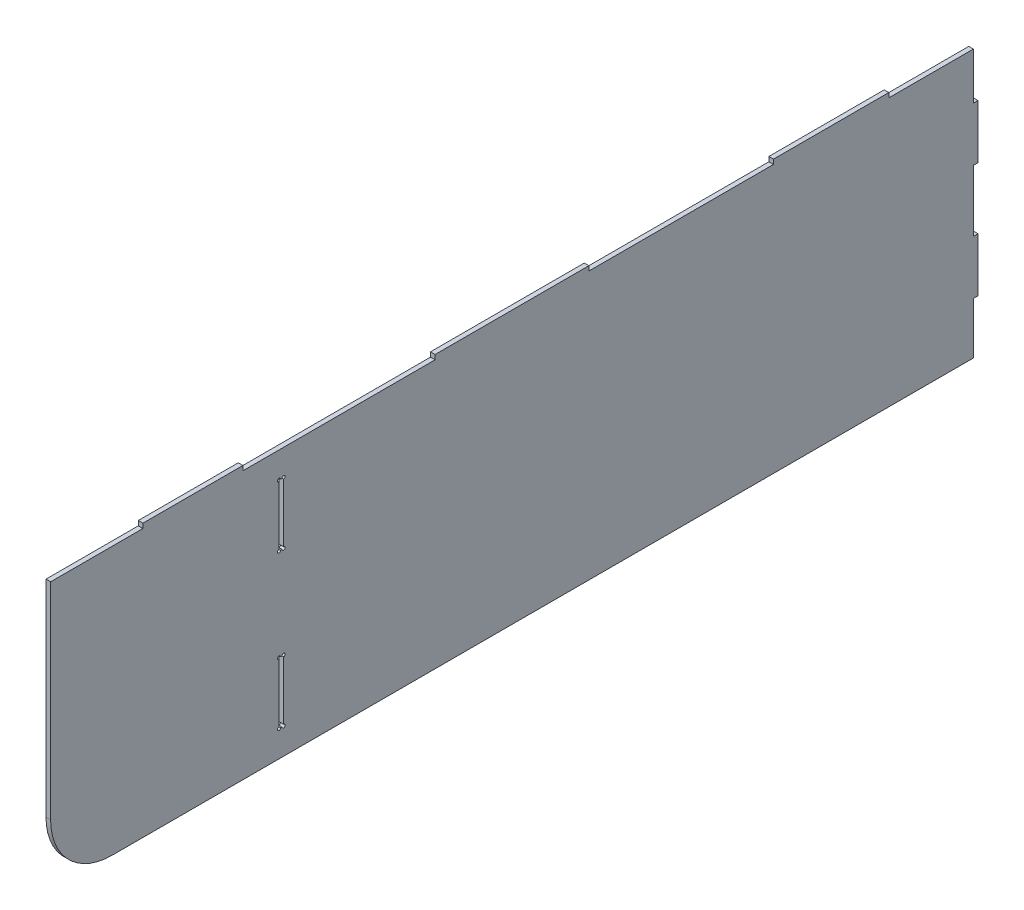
SolidWorks part; units mm, degrees
ref_plane "Front Plane" through (0, 0, 0) normal (0, 0, 1) x (1, 0, 0)
ref_plane "Top Plane" through (0, 0, 0) normal (0, 1, 0) x (1, 0, 0)
ref_plane "Right Plane" through (0, 0, 0) normal (1, 0, 0) x (0, 0, -1)
sketch "Sketch1" plane through (0, 0, 0) normal (0, 0, 1) x (1, 0, 0)
  line L2 (-598, 107) -> (-598, 168) construction
  line L5 (-598, -113) -> (-598, -180) construction
  line L10 (-598, 168) -> (-598, 174)
  line L14 (-604, 107) -> (-598, 107)
  line L15 (-604, 107) -> (-604, 37)
  line L16 (-604, 37) -> (-598, 37)
  line L17 (-598, 107) -> (-598, 37)
  line L18 (-604, -43) -> (-598, -43)
  line L19 (-604, -43) -> (-604, -113)
  line L20 (-604, -113) -> (-598, -113)
  line L21 (-598, -43) -> (-598, -113)
  line L74 (-598, 174) -> (-604, 174)
  line L75 (-598, 174) -> (-598, -180)
  line L76 (-598, -180) -> (-604, -180)
  line L77 (-604, 174) -> (-604, -180)
extrude "Boss-Extrude1" add sketch "Sketch1" along normal blind 1200 contours L74 L77 L14 L75 L10 | L16 L77 L18 L75 | L20 L77 L76 L75
sketch "Sketch2" plane through (-604, 0, 0) normal (-1, 0, 0) x (0, 0, 1)
  line L1 (0, 107) -> (-6, 107)
  line L2 (0, 107) -> (0, 37)
  line L3 (0, 37) -> (-6, 37)
  line L4 (-6, 107) -> (-6, 37)
  line L5 (0, -43) -> (-6, -43)
  line L6 (0, -43) -> (0, -113)
  line L7 (0, -113) -> (-6, -113)
  line L8 (-6, -43) -> (-6, -113)
  line L9 (0, 174) -> (1200, 174)
  line L10 (0, 174) -> (0, -180)
  line L11 (0, -180) -> (1200, -180)
  line L12 (1200, 174) -> (1200, -180)
  dimension "D1" = 6
  dimension "D2" = 6
extrude "Boss-Extrude2" add sketch "Sketch2" against normal up to surface (6 mm away) contours L5 L8 L7 L6 | L1 L4 L3 L2 | L12 L2 L10 L6 L11 M8
sketch "Sketch3" plane through (0, 0, 1200) normal (0, 0, 1) x (1, 0, 0)
  line L0 (-598, 174) -> (-598, -180) construction
  line L1 (-604, 174) -> (-598, 174)
  line L2 (-604, 174) -> (-604, 168)
  line L3 (-604, 168) -> (-598, 168)
  line L4 (-598, 174) -> (-598, 168)
  line L5 (-610, 168) -> (610, 168) construction
extrude "Cut-Extrude1" cut sketch "Sketch3" against normal blind 1666
sketch "Sketch4" plane through (-604, 0, 0) normal (-1, 0, 0) x (0, 0, 1)
  line L0 (900, 168) -> (900, -180) construction
  line L1 (0, 168) -> (1200, 168) construction
  line L2 (0, -180) -> (1200, -180) construction
  line L4 (900, -6) -> (956.1857, -6) construction
  line L5 (897, 134) -> (903, 134)
  line L6 (897, 134) -> (897, 54)
  line L7 (897, 54) -> (903, 54)
  line L8 (903, 134) -> (903, 54)
  line L9 (897, 134) -> (903, 54) construction
  line L10 (897, 54) -> (903, 134) construction
  line L11 (897, -66) -> (903, -66)
  line L12 (897, -66) -> (897, -146)
  line L13 (897, -146) -> (903, -146)
  line L14 (903, -66) -> (903, -146)
  line L15 (897, -66) -> (903, -146) construction
  line L16 (897, -146) -> (903, -66) construction
  circle A0 centre (903, 134) radius 2
  circle A1 centre (897, 134) radius 2
  circle A2 centre (903, 54) radius 2
  circle A3 centre (897, 54) radius 2
  circle A4 centre (903, -66) radius 2
  circle A5 centre (897, -66) radius 2
  circle A6 centre (903, -146) radius 2
  circle A7 centre (897, -146) radius 2
  point P6 (900, 94)
  point P12 (900, -106)
  dimension "D8" = 4
  dimension "D9" = 4
  dimension "D10" = 4
  dimension "D11" = 4
  dimension "D12" = 4
  dimension "D13" = 4
  dimension "D14" = 4
  dimension "D15" = 4
  dimension "D1" = 900
  dimension "D2" = 6
  dimension "D3" = 6
  dimension "D4" = 80
  dimension "D5" = 80
  dimension "D6" = 60
  dimension "D7" = 60
extrude "Cut-Extrude2" cut sketch "Sketch4" against normal blind 1666 contours A3 L7 A2 L8 A0 L5 A1 L6 | L8 A0 L5 | L5 A0 L8 | L6 A1 L5 | L5 A1 L6 | L7 A2 L8 | L8 A2 L7 | L7 A3 L6 | L6 A3 L7 | L11 A4 L14 | L14 A4 L11 | A7 L13 A6 L14 A4 L11 A5 L12 | L12 A5 L11 | L11 A5 L12 | L14 A6 L13 | L13 A6 L14 | L12 A7 L13 | L13 A7 L12
sketch "Sketch5" plane through (-604, 0, 0) normal (-1, 0, 0) x (0, 0, 1)
  line L0 (110.3135, 168) -> (260.1129, 168) construction
  line L1 (0, 168) -> (1200, 168) construction
  line L3 (500, 162) -> (700, 162)
  line L4 (500, 162) -> (500, 174)
  line L5 (500, 174) -> (700, 174)
  line L6 (700, 162) -> (700, 174)
  line L7 (500, 162) -> (700, 174) construction
  line L8 (500, 174) -> (700, 162) construction
  line L9 (950, 162) -> (1080, 162)
  line L10 (950, 162) -> (950, 174)
  line L11 (950, 174) -> (1080, 174)
  line L12 (1080, 162) -> (1080, 174)
  line L13 (950, 162) -> (1080, 174) construction
  line L14 (950, 174) -> (1080, 162) construction
  line L17 (110, 162) -> (260, 162)
  line L18 (110, 162) -> (110, 174)
  line L19 (110, 174) -> (260, 174)
  line L20 (260, 162) -> (260, 174)
  line L21 (110, 162) -> (260, 174) construction
  line L22 (110, 174) -> (260, 162) construction
  point P4 (600, 168)
  point P9 (1015, 168)
  point P16 (185, 168)
  dimension "D1" = 200
  dimension "D2" = 12
  dimension "D3" = 130
  dimension "D4" = 250
  dimension "D5" = 240
  dimension "D6" = 12
  dimension "D7" = 150
  dimension "D8" = 12
extrude "Boss-Extrude3" add sketch "Sketch5" against normal up to surface (6 mm away)
fillet "Fillet1" radius 80 1 edges at (-601, -180, 1200)
